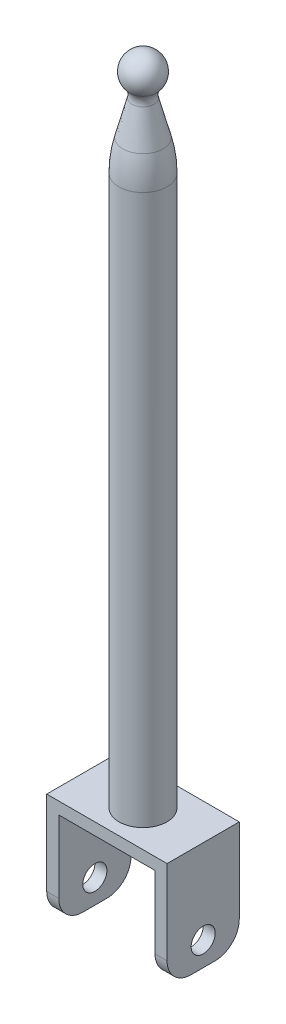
SolidWorks part; units mm, degrees
ref_plane "Front Plane" through (0, 0, 0) normal (0, 0, 1) x (1, 0, 0)
ref_plane "Top Plane" through (0, 0, 0) normal (0, 1, 0) x (1, 0, 0)
ref_plane "Right Plane" through (0, 0, 0) normal (1, 0, 0) x (0, 0, -1)
sketch "Sketch1" plane through (0, 0, 0) normal (0, 0, 1) x (1, 0, 0)
  line L0 (0, 0) -> (10, 0)
  line L1 (10, 0) -> (10, 263.4908)
  line L2 (8.3335, 276.2922) -> (4.5736, 290.4882)
  line L3 (0, 331.8619) -> (0, -35.4629) construction
  line L4 (0, 307.5) -> (0, 0)
  arc A0 (5.6442, 295.061) -> (0, 307.5) centre (0, 300) ccw
  arc A1 (10, 263.4908) -> (8.3335, 276.2922) centre (-40, 263.4908) ccw
  arc A4 (4.5736, 290.4882) -> (5.6442, 295.061) centre (9.4069, 291.7684) cw
  point P10 (0, 0)
  point P17 (-3.7714, 293.5172)
  point P20 (3.7714, 293.5172)
  dimension "D2" = 15
  dimension "D3" = 50
  dimension "D6" = 5
revolve "Revolve5" add sketch "Sketch1" angle 360 about L3
sketch "Sketch2" plane through (0, 0, 0) normal (0, -1, 0) x (1, 0, 0)
  circle A0 centre (0, 0) radius 10
extrude "Cut-Extrude1" cut sketch "Sketch2" against normal blind 35
sketch "Sketch3" plane through (0, 35, 0) normal (0, -1, 0) x (1, 0, 0)
  line L3 (-25, -15) -> (25, -15)
  line L4 (-25, -15) -> (-25, 15)
  line L5 (-25, 15) -> (25, 15)
  line L6 (25, -15) -> (25, 15)
  dimension "D3" = 30
  dimension "D4" = 50
extrude "Boss-Extrude1" add sketch "Sketch3" along normal blind 45
sketch "Sketch4" plane through (0, -10, 0) normal (0, -1, 0) x (1, 0, 0)
  line L1 (-25, -15) -> (25, -15) construction
  line L3 (25, 15) -> (-25, 15) construction
  line L4 (-15, -15) -> (15, -15)
  line L5 (-15, -15) -> (-15, 15)
  line L6 (-15, 15) -> (15, 15)
  line L7 (15, -15) -> (15, 15)
  dimension "D2" = 30
extrude "Cut-Extrude2" cut sketch "Sketch4" against normal blind 40
sketch "Sketch5" plane through (0, -10, 0) normal (0, -1, 0) x (1, 0, 0)
  line L0 (-15, 15) -> (-25, 15) construction
  line L1 (-15, -15) -> (-20, -15)
  line L2 (-15, -15) -> (-15, 15)
  line L3 (-15, 15) -> (-20, 15)
  line L4 (-20, -15) -> (-20, 15)
  dimension "D1" = 5
extrude "Cut-Extrude3" cut sketch "Sketch5" against normal blind 40
sketch "Sketch6" plane through (0, -10, 0) normal (0, -1, 0) x (1, 0, 0)
  line L0 (25, 15) -> (15, 15) construction
  line L1 (15, -15) -> (20, -15)
  line L2 (15, -15) -> (15, 15)
  line L3 (15, 15) -> (20, 15)
  line L4 (20, -15) -> (20, 15)
extrude "Cut-Extrude4" cut sketch "Sketch6" against normal blind 40
sketch "Sketch7" plane through (-25, 0, 0) normal (-1, 0, 0) x (0, 0, 1)
  circle A0 centre (0, 0) radius 5
  dimension "D1" = 10
extrude "Cut-Extrude5" cut sketch "Sketch7" against normal blind 50
fillet "Fillet1" radius 10 4 edges at (22.5, -10, 15) (22.5, -10, -15) (-22.5, -10, 15) (-22.5, -10, -15)
